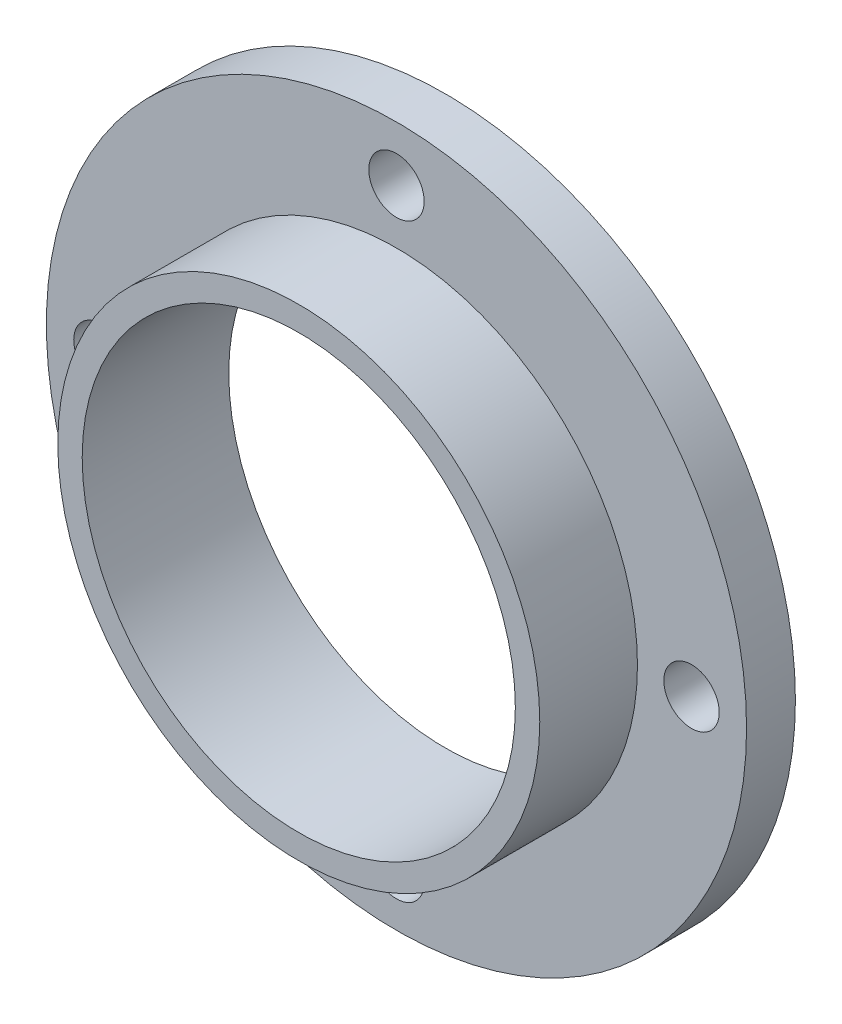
SolidWorks part; units mm, degrees
ref_plane "Plan de face" through (0, 0, 0) normal (0, 0, 1) x (1, 0, 0)
ref_plane "Plan de dessus" through (0, 0, 0) normal (0, 1, 0) x (1, 0, 0)
ref_plane "Plan de droite" through (0, 0, 0) normal (1, 0, 0) x (0, 0, -1)
sketch "Esquisse1" plane through (0, 0, 0) normal (0, 0, 1) x (1, 0, 0)
  line L0 (0, -51.0718) -> (0, 64.3434) construction
  line L1 (55.1007, 0) -> (-88.5166, 0) construction
  circle A0 centre (0, 0) radius 21.5
  circle A1 centre (0, 0) radius 13.3
  circle A2 centre (0, 0) radius 18.15 construction
  circle A3 centre (0, 18.1199) radius 1.7
  circle A4 centre (0, -18.1199) radius 1.7
  circle A5 centre (18.1199, 0) radius 1.7
  circle A6 centre (-18.1199, 0) radius 1.7
extrude "Extrusion1" add sketch "Esquisse1" along normal blind 9
sketch "Esquisse2" plane through (0, 0, 9) normal (0, 0, 1) x (1, 0, 0)
  circle A0 centre (0, 0) radius 22.4204
  circle A1 centre (0, 0) radius 14.8
extrude "Enlèv. mat.-Extru.1" cut sketch "Esquisse2" against normal blind 6
